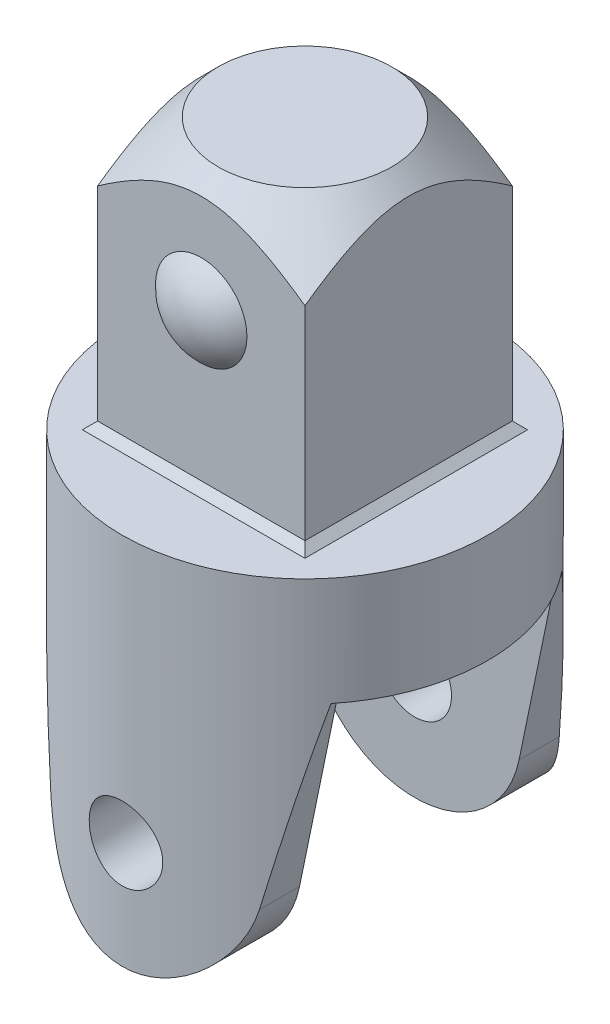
SolidWorks part; units mm, degrees
ref_plane "Front Plane" through (0, 0, 0) normal (0, 0, 1) x (1, 0, 0)
ref_plane "Top Plane" through (0, 0, 0) normal (0, 1, 0) x (1, 0, 0)
ref_plane "Right Plane" through (0, 0, 0) normal (1, 0, 0) x (0, 0, -1)
sketch "Sketch1" plane through (0, 0, 0) normal (0, 1, 0) x (1, 0, 0)
  circle A0 centre (0, 0) radius 12
  dimension "D1" = 24
extrude "Boss-Extrude1" add sketch "Sketch1" along normal blind 33.53
sketch "Sketch2" plane through (0, 33.53, 0) normal (0, 1, 0) x (1, 0, 0)
  line L0 (-6.5, 6.5) -> (-2.5, 6.5)
  line L1 (-6.5, 6.5) -> (6.5, 6.5) construction
  line L2 (-6.5, 6.5) -> (-6.5, -6.5) construction
  line L3 (-6.5, -6.5) -> (6.5, -6.5) construction
  line L4 (6.5, 6.5) -> (6.5, -6.5) construction
  line L5 (-6.5, 6.5) -> (6.5, -6.5) construction
  line L6 (-6.5, -6.5) -> (6.5, 6.5) construction
  line L7 (2.5, 6.5) -> (6.5, 6.5)
  line L8 (6.5, 6.5) -> (6.5, 2.5)
  line L9 (6.5, -2.5) -> (6.5, -6.5)
  line L10 (6.5, -6.5) -> (2.5, -6.5)
  line L11 (-2.5, -6.5) -> (-6.5, -6.5)
  line L12 (-6.5, -6.5) -> (-6.5, -2.5)
  line L13 (-6.5, 2.5) -> (-6.5, 6.5)
  arc A0 (-2.5, 6.5) -> (2.5, 6.5) centre (0, 2.4611) cw
  arc A1 (6.5, 2.5) -> (6.5, -2.5) centre (2.4611, 0) cw
  arc A2 (2.5, -6.5) -> (-2.5, -6.5) centre (0, -2.4611) cw
  arc A3 (-6.5, -2.5) -> (-6.5, 2.5) centre (-2.4611, 0) cw
  point P0 (0, 0)
  point P9 (0, 7.2111)
  point P28 (0, 0)
  dimension "D3" = 4.75
  dimension "D1" = 13
  dimension "D2" = 4
  dimension "D4" = 4
extrude "Cut-Extrude1" cut sketch "Sketch2" against normal blind 19.6
chamfer "Chamfer1" distance 0.4 angle 45 4 edges at (-6.5, 23.73, 6.5) (6.5, 23.73, 6.5) (-6.5, 23.73, -6.5) (6.5, 23.73, -6.5)
sketch "Sketch3" plane through (0, 33.53, 0) normal (0, 1, 0) x (1, 0, 0)
  circle A0 centre (0, 0) radius 9.375
  dimension "D1" = 18.75
extrude "Cut-Extrude2" cut sketch "Sketch3" against normal blind 3.4 draft 35
sketch "Sketch4" plane through (0, 0, 0) normal (0, -1, 0) x (1, 0, 0)
  line L1 (-12, 7.2111) -> (12, 7.2111)
  line L2 (-12, 7.2111) -> (-12, -7.2111)
  line L3 (-12, -7.2111) -> (12, -7.2111)
  line L4 (12, 7.2111) -> (12, -7.2111)
  arc A0 (2.5, 6.5) -> (-2.5, 6.5) centre (0, 2.4611) ccw construction
  arc A1 (-2.5, -6.5) -> (2.5, -6.5) centre (0, -2.4611) ccw construction
  circle A2 centre (0, 0) radius 12 construction
extrude "Cut-Extrude3" cut sketch "Sketch4" against normal blind 17.4
sketch "Sketch5" plane through (0, 0, 0) normal (0, 0, 1) x (1, 0, 0)
  line L0 (12, 17.4) -> (9.3, 17.4)
  line L1 (9.3, 17.4) -> (6.8548, 5.5817)
  line L2 (0, 0) -> (0, 33.53) construction
  line L3 (12, 33.53) -> (-12, 33.53) construction
  line L4 (-12, 17.4) -> (-9.3, 17.4)
  line L5 (-9.3, 17.4) -> (-6.8548, 5.5817)
  line L6 (-6.8548, 5.5817) -> (6.8548, 5.5817) construction
  line L7 (-12, 17.4) -> (-12, -3.1923)
  line L8 (-12, -3.1923) -> (12, -3.1923)
  line L9 (12, -3.1923) -> (12, 17.4)
  arc A0 (-6.8548, 5.5817) -> (6.8548, 5.5817) centre (0, 7) ccw
  circle A1 centre (0, 7) radius 2.415
  dimension "D1" = 7
  dimension "D3" = 4.83
  dimension "D2" = 2.7
extrude "Cut-Extrude4" cut sketch "Sketch5" against normal mid plane 67.4 contours A1 | A0 L5 L4 L7 L8 L9 L0 L1
sketch "Sketch6" plane through (0, 33.53, 0) normal (0, 1, 0) x (1, 0, 0)
  circle A0 centre (0, 0) radius 12
extrude "Cut-Extrude5" cut sketch "Sketch6" against normal blind 9
sketch "Sketch7" plane through (0, 24.53, 0) normal (0, 1, 0) x (1, 0, 0)
  circle A1 centre (0, 0) radius 12
  circle A2 centre (0, 0) radius 12
  dimension "D1" = 0
extrude "Boss-Extrude2" add sketch "Sketch7" against normal up to surface (7.13 mm away)
sketch "Sketch8" plane through (0, 24.53, 0) normal (0, 1, 0) x (1, 0, 0)
  line L1 (-6.81, 6.81) -> (6.81, 6.81)
  line L2 (-6.81, 6.81) -> (-6.81, -6.81)
  line L3 (-6.81, -6.81) -> (6.81, -6.81)
  line L4 (6.81, 6.81) -> (6.81, -6.81)
  line L5 (-6.81, 6.81) -> (6.81, -6.81) construction
  line L6 (-6.81, -6.81) -> (6.81, 6.81) construction
  point P0 (0, 0)
  dimension "D1" = 13.62
extrude "Boss-Extrude3" add sketch "Sketch8" along normal blind 17.8
ref_axis "Axis1" through (0, 44.4465, 0) along (0, -1, 0)
sketch "Sketch9" plane through (0, 0, 0) normal (0, 0, 1) x (1, 0, 0)
  line L0 (5.7, 42.33) -> (13.1113, 42.33)
  line L1 (-6.81, 42.33) -> (6.81, 42.33) construction
  line L2 (13.1113, 42.33) -> (13.1113, 34.9187)
  line L3 (13.1113, 34.9187) -> (5.7, 42.33)
  line L4 (0, 44.4465) -> (0, -2.1165) construction
  dimension "D1" = 45
  dimension "D2" = 5.7
revolve "Cut-Revolve1" cut sketch "Sketch9" angle 360 about axis through (0, 44.4465, 0) along (0, -1, 0)
chamfer "Chamfer2" distance 0.5 angle 45 4 edges at (0, 24.53, -6.81) (6.81, 24.53, 0) (-6.81, 24.53, 0) (0, 24.53, 6.81)
sketch "Sketch10" plane through (0, 0, 0) normal (1, 0, 0) x (0, 0, -1)
  line L0 (6.81, 34.73) -> (6.81, 31.73)
  line L1 (6.81, 38.3992) -> (6.81, 25.03) construction
  line L2 (6.81, 34.73) -> (8.16, 34.73) construction
  line L3 (5.7, 42.33) -> (-5.7, 42.33) construction
  line L4 (6.81, 34.73) -> (8.16, 34.73)
  arc A0 (8.16, 34.73) -> (6.81, 31.73) centre (4.1517, 34.73) cw
  dimension "D1" = 7.6
  dimension "D2" = 3
  dimension "D3" = 1.35
revolve "Revolve1" add sketch "Sketch10" angle 360 about L2
mirror "Mirror1" about plane through (0, 0, 0) normal (0, 0, 1) of "Revolve1"
